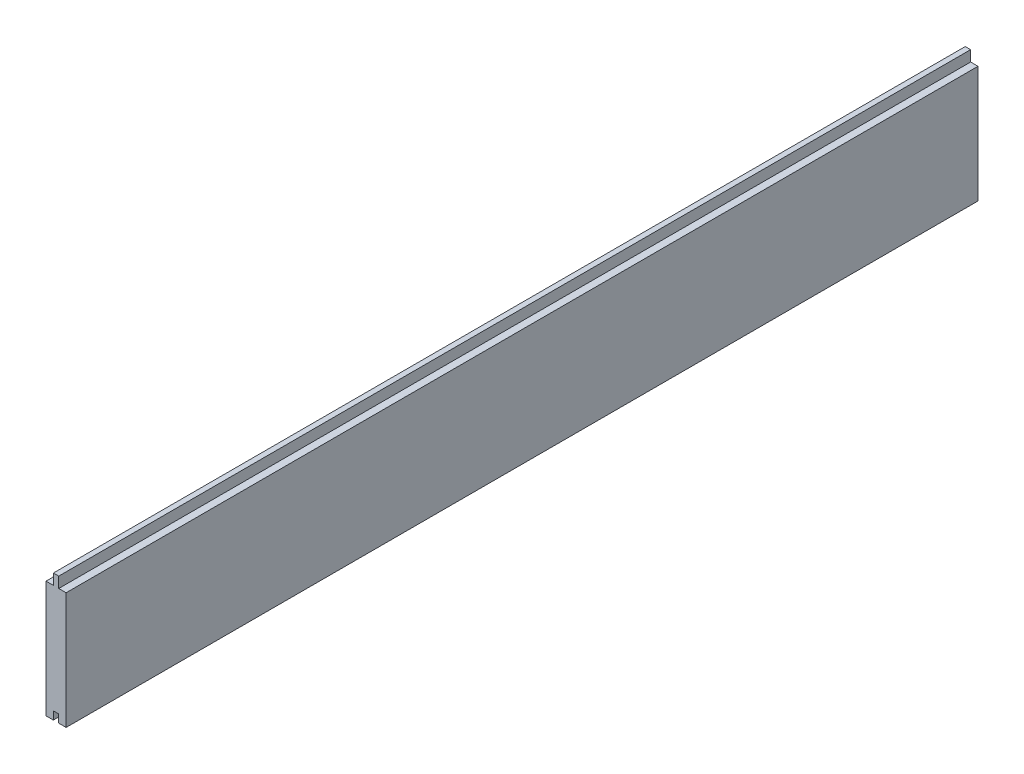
SolidWorks part; units mm, degrees
ref_plane "Plan de face" through (0, 0, 0) normal (0, 0, 1) x (1, 0, 0)
ref_plane "Plan de dessus" through (0, 0, 0) normal (0, 1, 0) x (1, 0, 0)
ref_plane "Plan de droite" through (0, 0, 0) normal (1, 0, 0) x (0, 0, -1)
sketch "Esquisse1" plane through (0, 0, 0) normal (0, 0, 1) x (1, 0, 0)
  line L1 (-7.5, 43.5) -> (7.5, 43.5)
  line L2 (-7.5, 43.5) -> (-7.5, -43.5)
  line L3 (-7.5, -43.5) -> (7.5, -43.5)
  line L4 (7.5, 43.5) -> (7.5, -43.5)
  line L5 (-7.5, 43.5) -> (7.5, -43.5) construction
  line L6 (-7.5, -43.5) -> (7.5, 43.5) construction
  line L7 (-2, 51.5) -> (2, 51.5)
  line L8 (-2, 51.5) -> (-2, 35.5)
  line L9 (-2, 35.5) -> (2, 35.5)
  line L10 (2, 51.5) -> (2, 35.5)
  line L11 (-2, 51.5) -> (2, 35.5) construction
  line L12 (-2, 35.5) -> (2, 51.5) construction
  line L13 (-2, -37.5) -> (2, -37.5)
  line L14 (-2, -37.5) -> (-2, -49.5)
  line L15 (-2, -49.5) -> (2, -49.5)
  line L16 (2, -37.5) -> (2, -49.5)
  line L17 (-2, -37.5) -> (2, -49.5) construction
  line L18 (-2, -49.5) -> (2, -37.5) construction
  point P0 (0, 0)
  point P5 (0, 43.5)
  point P11 (0, -43.5)
  dimension "D1" = 87
  dimension "D2" = 15
  dimension "D3" = 4
  dimension "D4" = 16
  dimension "D5" = 4
  dimension "D6" = 12
extrude "Boss.-Extru.1" add sketch "Esquisse1" along normal blind 680 contours L13 L16 L3 L4 L1 L10 L9 L8 L2 L14
